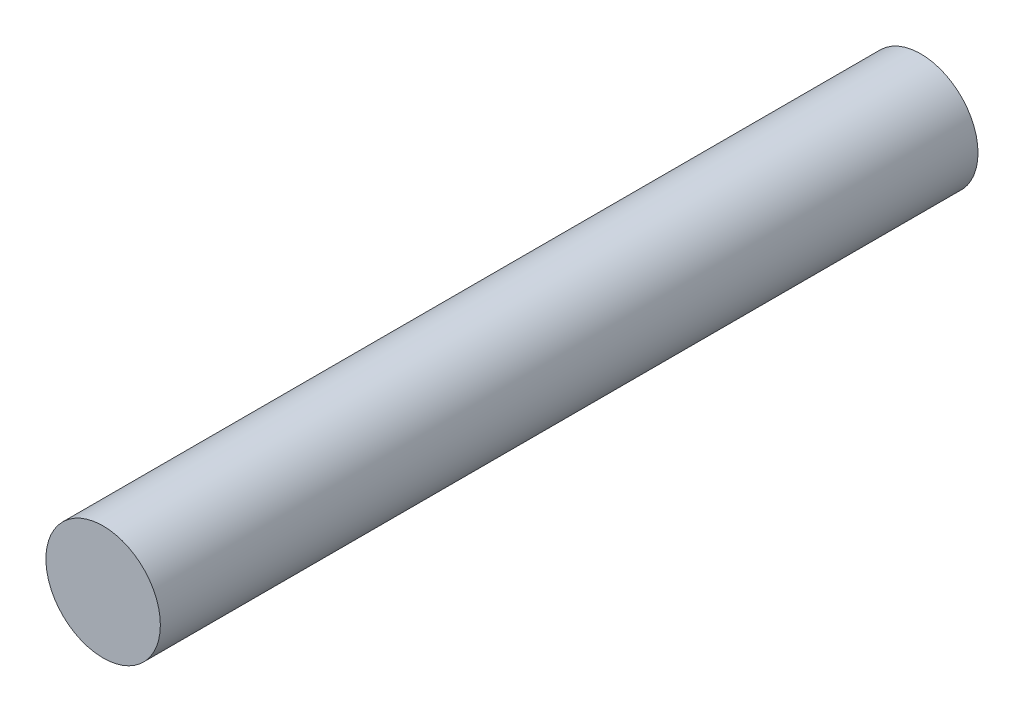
SolidWorks part; units mm, degrees
ref_plane "Front Plane" through (0, 0, 0) normal (0, 0, 1) x (1, 0, 0)
ref_plane "Top Plane" through (0, 0, 0) normal (0, 1, 0) x (1, 0, 0)
ref_plane "Right Plane" through (0, 0, 0) normal (1, 0, 0) x (0, 0, -1)
sketch "Sketch1" plane through (0, 0, 0) normal (0, 0, 1) x (1, 0, 0)
  circle A0 centre (0, 0) radius 52.5
  dimension "D1" = 105
extrude "Boss-Extrude1" add sketch "Sketch1" along normal blind 750
